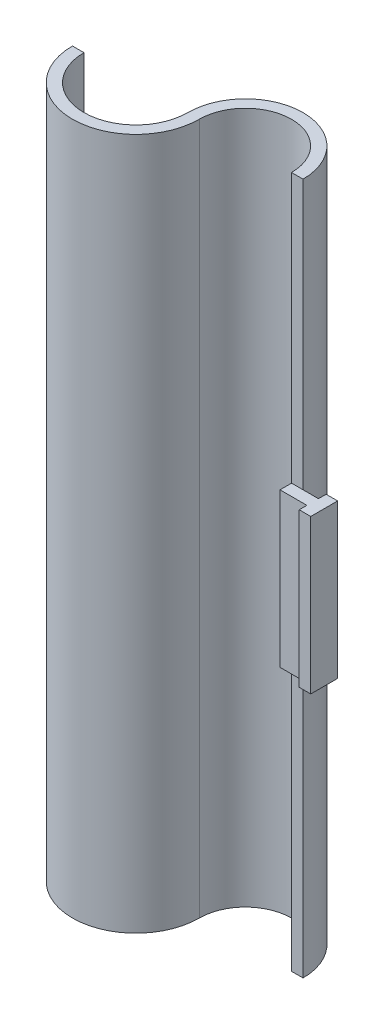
SolidWorks part; units mm, degrees
ref_plane "Front Plane" through (0, 0, 0) normal (0, 0, 1) x (1, 0, 0)
ref_plane "Top Plane" through (0, 0, 0) normal (0, 1, 0) x (1, 0, 0)
ref_plane "Right Plane" through (0, 0, 0) normal (1, 0, 0) x (0, 0, -1)
sketch "Sketch11" plane through (0, 0, 0) normal (0, 1, 0) x (1, 0, 0)
  line L0 (-30, 14.7285) -> (-30, -24.0358) construction
  line L1 (-60, 0) -> (-57, 0)
  line L2 (-35, 15) -> (-15, 15) construction
  line L3 (-3, 0) -> (0, 0)
  arc A0 (0, 0) -> (-30, 0) centre (-15, 0) ccw
  arc A1 (-27, 0) -> (-60, 0) centre (-43.5, 0) cw
  arc A2 (-3, 0) -> (-27, 0) centre (-15, 0) ccw
  arc A3 (-30, 0) -> (-57, 0) centre (-43.5, 0) cw
  point P7 (-15, 12)
  point P8 (-15, 15)
  point P16 (-43.5, -13.5)
  point P18 (-43.5, -16.5)
extrude "Boss-Extrude1" add sketch "Sketch11" along normal blind 180
sketch "Sketch12" plane through (0, 180, 0) normal (0, 1, 0) x (1, 0, 0)
  line L0 (4, -3) -> (4, -5) construction
  line L1 (-3, 0) -> (4, 0) construction
  line L2 (-3, 0) -> (-3, -3) construction
  line L3 (-3, -3) -> (4, -3) construction
  line L5 (4, 2) -> (7, 2) construction
  line L6 (4, 2) -> (4, 0) construction
  line L7 (4, -5) -> (7, -5) construction
  line L8 (7, 2) -> (7, -5) construction
sketch "Sketch13" plane through (0, 0, 0) normal (0, 0, 1) x (1, 0, 0)
  line L0 (-24.5582, 0) -> (-24.5582, 90) construction
  line L1 (-60, 0) -> (-27, 0) construction
ref_plane "Plane1" through (0, 90, 0) normal (0, 1, 0) x (1, 0, 0)
sketch "Sketch14" plane through (0, 90, 0) normal (0, 1, 0) x (1, 0, 0)
  line L0 (4, 2) -> (4, 0) construction
  line L1 (4, 2) -> (7, 2) construction
  line L2 (7, 2) -> (7, -5) construction
  line L3 (4, -5) -> (7, -5) construction
  line L4 (4, -3) -> (4, -5) construction
  line L5 (-3, -3) -> (4, -3) construction
  line L6 (-3, 0) -> (-3, -3) construction
  line L7 (-3, 0) -> (4, 0) construction
  line L8 (4, 2) -> (4, 0)
  line L9 (4, 2) -> (7, 2)
  line L10 (7, 2) -> (7, -5)
  line L11 (4, -5) -> (7, -5)
  line L12 (4, -3) -> (4, -5)
  line L13 (-3, -3) -> (4, -3)
  line L14 (-3, 0) -> (-3, -3)
  line L15 (-3, 0) -> (4, 0)
extrude "Boss-Extrude2" add sketch "Sketch14" along normal mid plane 40
equation "\"ExternalDiameterBallBearing\"= 22mm"
equation "\"InternalDiameterBallBearing\"= 8mm"
equation "\"HeightJoints\"= 40mm"
equation "\"WidthJoints\"= 3mm"
equation "\"LenghtJoints\"= 7mm"
equation "\"DeepnessJoints\"= 60mm"
equation "\"TurbineShaftDiameter\"= 40mm"
equation "\"HeightTurbine\"= 180mm"
equation "\"HeightBlade\"= 180mm"
equation "\"HeightBallBearing\"= 7mm"
equation "\"LenghtBlade\"= 60mm"
equation "\"D5@Sketch11\"=\"WidthJoints\""
equation "\"D1@Sketch11\"=\"WidthJoints\""
equation "\"D2@Sketch11\"=\"LenghtBlade\"/2 +3"
equation "\"D3@Sketch11\"=\"WidthJoints\""
equation "\"D4@Sketch11\"=\"WidthJoints\""
equation "\"D1@Sketch12\"=\"WidthJoints\"*2 + \"ErrorForJointsBlade\""
equation "\"D2@Sketch12\"=\"WidthJoints\""
equation "\"D3@Sketch12\"=\"WidthJoints\""
equation "\"D4@Sketch12\"=\"LenghtJoints\""
equation "\"D1@Boss-Extrude1\"=\"HeightBlade\""
equation "\"D1@Sketch13\"=\"HeightBlade\"/2"
equation "\"D1@Boss-Extrude2\"=\"HeightJoints\""
equation "\"D7@Sketch11\"=\"LenghtBlade\"/2"
equation "\"Widthblade\"= 3mm"
equation "\"HeightBase\"= 20mm"
equation "\"HeightBox\"= 40mm"
equation "\"Lsqare\"= 90mm"
equation "\"lenghtJointsForBox\"=30mm"
equation "\"ErrorForJoints1\"=0.8mm"
equation "\"ErrorForJoints2\"=0.4mm"
equation "\"ErrorForJointsBlade\"=1mm"
